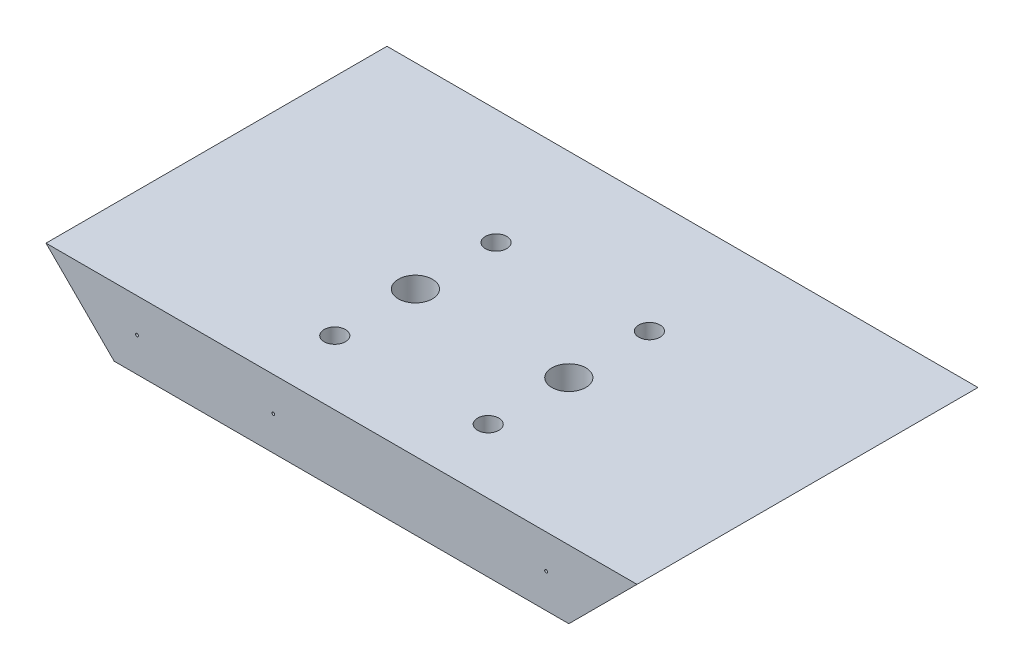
SolidWorks part; units mm, degrees
ref_plane "Front Plane" through (0, 0, 0) normal (0, 0, 1) x (1, 0, 0)
ref_plane "Top Plane" through (0, 0, 0) normal (0, 1, 0) x (1, 0, 0)
ref_plane "Right Plane" through (0, 0, 0) normal (1, 0, 0) x (0, 0, -1)
sketch "Sketch1" plane through (0, 0, 0) normal (0, 1, 0) x (1, 0, 0)
  line L1 (0, 0) -> (330.2, 0)
  line L2 (0, 0) -> (0, 190.5)
  line L3 (0, 190.5) -> (330.2, 190.5)
  line L4 (330.2, 0) -> (330.2, 190.5)
  dimension "D1" = 330.2
  dimension "D2" = 190.5
extrude "Boss-Extrude1" add sketch "Sketch1" along normal blind 38.1
hole_wizard "1/16 (0.0625) Diameter Hole7" positions "Sketch2" profile "Sketch4" hole size "1/16" standard "ANSI Inch"
sketch "Sketch2" plane through (0, 0, 0) normal (0, 0, 1) x (1, 0, 0)
  point P0 (50.8, 19.05)
  point P2 (279.4, 19.05)
  point P9 (127, 19.05)
  dimension "D1" = 50.8
  dimension "D2" = 127
  dimension "D3" = 19.05
  dimension "D4" = 50.8
sketch "Sketch4" plane through (50.8, 19.05, 0) normal (1, 0, 0) x (0, -1, 0)
  line L0 (0, 0) -> (0, 51.2769)
  line L1 (0, 51.2769) -> (0.7937, 50.8)
  line L2 (0.7937, 50.8) -> (0.7937, 0)
  line L5 (0.7937, 0) -> (0, 0)
  line L10 (0, 51.2769) -> (-0.7938, 50.8) construction
  line L11 (0, -6.35) -> (0, 107.95) construction
  dimension "Hole Dia." = 1.5875
  dimension "Hole Depth" = 50.8
  dimension "Drill Angle" = 118
hole_wizard "3/4 (0.75) Diameter Hole1" positions "Sketch12" profile "Sketch14" hole size "3/4" standard "ANSI Inch"
sketch "Sketch12" plane through (0, 0, 0) normal (0, -1, 0) x (-1, 0, 0)
  line L0 (0, 0) -> (-330.2, 0) construction
  point P0 (-211.1375, 80.9625)
  point P13 (-125.4125, 80.9625)
  dimension "D1" = 119.0625
  dimension "D2" = 80.9625
  dimension "D3" = 204.7875
  dimension "D4" = 125.4125
sketch "Sketch14" plane through (211.1375, 0, -80.9625) normal (1, 0, 0) x (0, 0, -1)
  line L0 (0, 0) -> (0, 38.1)
  line L1 (0, 38.1) -> (9.525, 38.1)
  line L2 (9.525, 38.1) -> (9.525, 0)
  line L5 (9.525, 0) -> (0, 0)
  line L11 (0, -6.35) -> (0, 107.95) construction
  dimension "Thru Hole Dia." = 19.05
  dimension "Thru Hole Depth" = 38.1
hole_wizard "15/32 (0.46875) Diameter Hole1" positions "Sketch21" profile "Sketch22" hole size "15/32" standard "ANSI Inch"
sketch "Sketch21" plane through (0, 38.1, 0) normal (0, 1, 0) x (1, 0, 0)
  point P0 (125.4125, 35.9172)
  point P2 (125.4125, 126.0078)
  point P19 (211.1375, 126.0078)
  point P21 (211.1375, 35.9172)
  dimension "D1" = 119.0625
  dimension "D4" = 35.9172
  dimension "D5" = 90.0906
  dimension "D6" = 204.7875
sketch "Sketch22" plane through (125.4125, 38.1, -35.9172) normal (1, 0, 0) x (0, 0, 1)
  line L0 (0, 0) -> (0, 38.1)
  line L1 (0, 38.1) -> (5.9531, 38.1)
  line L2 (5.9531, 38.1) -> (5.9531, 0)
  line L5 (5.9531, 0) -> (0, 0)
  line L11 (0, -6.35) -> (0, 107.95) construction
  dimension "Thru Hole Dia." = 11.9062
  dimension "Thru Hole Depth" = 38.1
chamfer "Chamfer2" distance 38.1 angle 45 2 edges at (330.2, 0, -95.25) (0, 0, -95.25)
